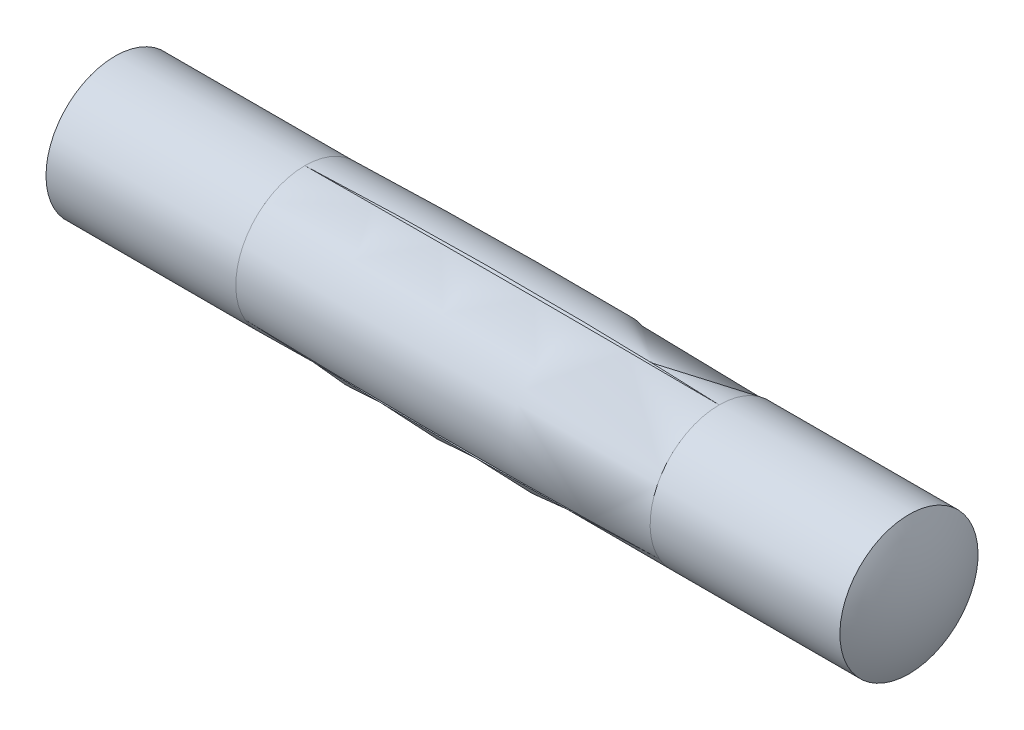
SolidWorks part; units mm, degrees
ref_plane "Plane1" through (0, 0, 0) normal (0, 0, 1) x (1, 0, 0)
ref_plane "Plane2" through (0, 0, 0) normal (0, 1, 0) x (1, 0, 0)
ref_plane "Plane3" through (0, 0, 0) normal (1, 0, 0) x (0, 0, -1)
sketch "Sketch1" plane through (0, 0, 0) normal (0, 0, 1) x (1, 0, 0)
  line L0 (-15, 0) -> (31.513, 0) construction
  line L1 (2.86, 0) -> (-2.86, 0) construction
  line L2 (-14.37, 2.5) -> (14.37, 2.5)
  line L3 (0, 19.94) -> (0, -13.9002) construction
  line L4 (0, -2.86) -> (0, 2.86) construction
  line L5 (-15, 0) -> (-15, -8.3947) construction
  line L6 (15, 0) -> (15, -8.3947) construction
  line L7 (-15, 0) -> (15, 0)
  arc A0 (-14.37, 2.5) -> (-15, 0) centre (-9.7247, 0) ccw
  arc A1 (14.37, 2.5) -> (15, 0) centre (9.7247, 0) cw
  dimension "l" = 30
  dimension "d" = 5
  dimension "c2" = 0.63
revolve "Revolve3" add sketch "Sketch1" angle 360 about L0
sketch "Sketch2" plane through (0, 0, 0) normal (0, 0, 1) x (1, 0, 0)
  line L0 (14.37, 2.5) -> (-14.37, 2.5) construction
  line L3 (0, 2.6) -> (6.8151, 2.6) construction
  line L4 (-7.5, 2.5) -> (-7.5, 0)
  line L5 (2.86, 0) -> (-2.86, 0) construction
  line L6 (-7.5, 0) -> (7.5, 0)
  line L7 (0, 2.6) -> (0, 0) construction
  line L8 (7.5, 2.5) -> (7.5, 0)
  line L9 (0, 0) -> (18.6878, 0) construction
  arc A0 (-7.5, 2.5) -> (7.5, 2.5) centre (0, -278.7) cw
  dimension "l2" = 15
  dimension "d2" = 5.2
revolve "Revolve4" add sketch "Sketch2" angle 360 about L9
sketch "Sketch3" plane through (0, 0, 0) normal (1, 0, 0) x (0, 0, -1)
  line L0 (0, 2.5) -> (-0.1147, 2.6638)
  line L1 (0, 2.9758) -> (0, -2.9758) construction
  line L2 (0, 2.5) -> (0, 2.9555) construction
  line L3 (0, 2.5) -> (0.1147, 2.6638)
  circle A0 centre (0, 0) radius 2.5 construction
  circle A1 centre (0, 0) radius 2.5 construction
  arc A2 (-0.1147, 2.6638) -> (0.1147, 2.6638) centre (0, 2.5) cw
  dimension "D1" = 0.2
  dimension "D2" = 70
extrude "Cut-Extrude1" cut sketch "Sketch3" against normal mid plane 15
pattern_circular "CirPattern2" count 3 over 360 about axis through (0, 0, 0) along (1, 0, 0) of "Cut-Extrude1"
equation "\"D1@Sketch3\" = \"d2@Sketch2\" - \"d@Sketch1\""
equation "\"D1@Cut-Extrude1\" = \"l2@Sketch2\""
